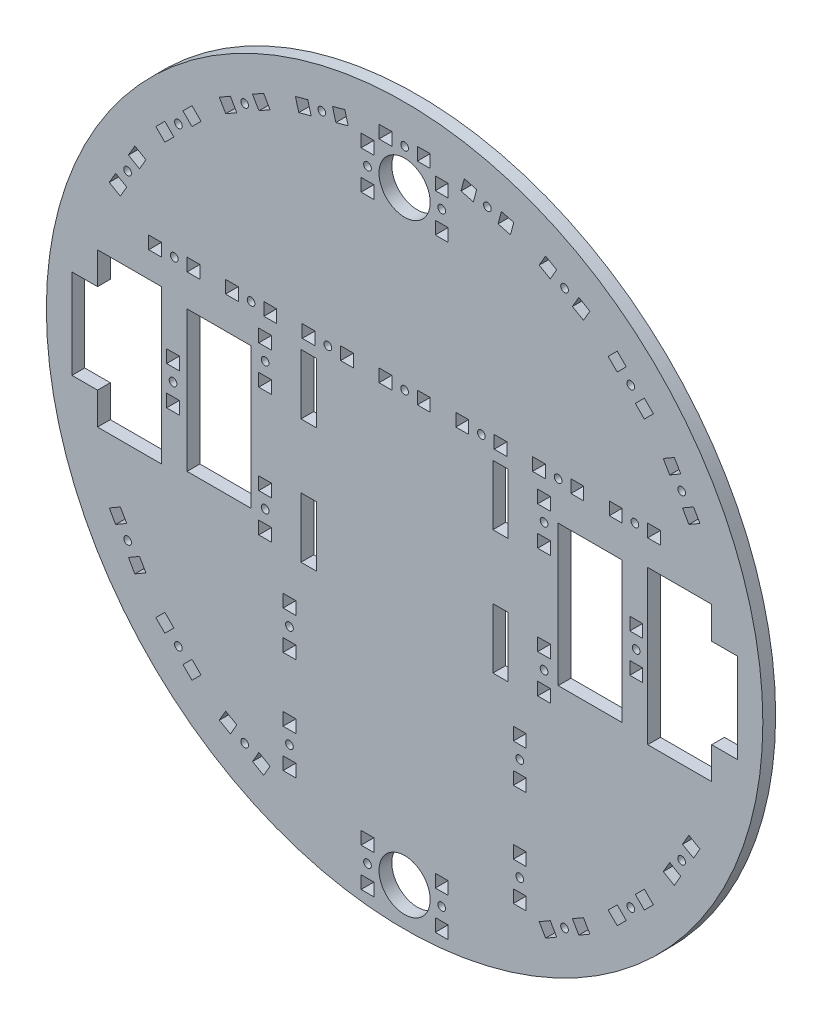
SolidWorks part; units mm, degrees
ref_plane "Plan de face" through (0, 0, 0) normal (0, 0, 1) x (1, 0, 0)
ref_plane "Plan de dessus" through (0, 0, 0) normal (0, 1, 0) x (1, 0, 0)
ref_plane "Plan de droite" through (0, 0, 0) normal (1, 0, 0) x (0, 0, -1)
sketch "Esquisse1" plane through (0, 0, 0) normal (0, 0, 1) x (1, 0, 0)
  line L0 (-52, 117.8953) -> (-52, -122.7008) construction
  line L1 (0, -140) -> (0, 140) construction
  line L2 (52, 117.8953) -> (52, -122.7008) construction
  line L3 (-140, 0) -> (140, 0) construction
  line L4 (-85, 27.5) -> (-85, -27.5)
  line L5 (85, 27.5) -> (60, 27.5)
  line L6 (85, 27.5) -> (85, -27.5)
  line L7 (85, -27.5) -> (60, -27.5)
  line L8 (60, 27.5) -> (60, -27.5)
  line L9 (-85, -27.5) -> (-60, -27.5)
  line L10 (-60, 27.5) -> (-60, -27.5)
  line L11 (-85, 27.5) -> (-60, 27.5)
  line L12 (45, -49.1556) -> (45, -122.7008) construction
  line L13 (-45, -49.1556) -> (-45, -122.7008) construction
  line L14 (-10, 139.6424) -> (-10, 125) construction
  line L15 (-10, 125) -> (10, 125) construction
  line L16 (10, 125) -> (10, 139.6424) construction
  line L17 (-52, 42.5) -> (52, 42.5) construction
  line L18 (95, 30) -> (95, -30)
  line L19 (95, -30) -> (120, -30)
  line L20 (120, -30) -> (120, -17.5)
  line L21 (120, -17.5) -> (130, -17.5)
  line L22 (130, -17.5) -> (130, 17.5)
  line L23 (130, 17.5) -> (120, 17.5)
  line L24 (120, 17.5) -> (120, 30)
  line L25 (120, 30) -> (95, 30)
  line L26 (-120, 17.5) -> (-120, 30)
  line L27 (-130, 17.5) -> (-120, 17.5)
  line L28 (-130, -17.5) -> (-130, 17.5)
  line L29 (-120, -17.5) -> (-130, -17.5)
  line L30 (-120, -30) -> (-120, -17.5)
  line L31 (-95, -30) -> (-120, -30)
  line L32 (-95, 30) -> (-95, -30)
  line L33 (-120, 30) -> (-95, 30)
  line L34 (-20.5104, -115) -> (24.0423, -115) construction
  line L35 (-26.3093, -125) -> (32.4158, -125) construction
  line L36 (-28.8401, -7) -> (32.4158, -7) construction
  line L37 (40.5, 36) -> (40.5, 12.5)
  line L38 (-40.5, 36) -> (-34.5, 36)
  line L39 (-40.5, 36) -> (-40.5, 12.5)
  line L40 (-40.5, 12.5) -> (-34.5, 12.5)
  line L41 (-34.5, 36) -> (-34.5, 12.5)
  line L42 (40.5, 12.5) -> (34.5, 12.5)
  line L43 (40.5, 36) -> (34.5, 36)
  line L44 (34.5, 36) -> (34.5, 12.5)
  line L45 (40.5, -36) -> (34.5, -36)
  line L46 (40.5, -36) -> (40.5, -12.5)
  line L47 (40.5, -12.5) -> (34.5, -12.5)
  line L48 (34.5, -36) -> (34.5, -12.5)
  line L49 (-40.5, -36) -> (-34.5, -36)
  line L50 (-34.5, -36) -> (-34.5, -12.5)
  line L51 (-40.5, -12.5) -> (-34.5, -12.5)
  line L52 (-40.5, -36) -> (-40.5, -12.5)
  circle A0 centre (0, 0) radius 140
  circle A1 centre (0, -125) radius 10
  circle A2 centre (0, 111) radius 10
  point P26 (0, 0)
  point P72 (-37.5, 36)
  line B0 (57, 30) -> (57, 35)
  line B1 (57, 30) -> (52, 30)
  line B2 (52, 30) -> (52, 35)
  line B3 (57, 35) -> (52, 35)
  line B4 (57, 20) -> (57, 15)
  line B5 (57, 20) -> (52, 20)
  line B6 (52, 20) -> (52, 15)
  line B7 (57, 15) -> (52, 15)
  line B8 (54.5, 25) -> (61.4724, 25) construction
  circle B9 centre (54.5, 25) radius 1.5
  line B10 (57, -30) -> (57, -35)
  line B11 (57, -30) -> (52, -30)
  line B12 (52, -30) -> (52, -35)
  line B13 (57, -35) -> (52, -35)
  line B14 (57, -20) -> (57, -15)
  line B15 (57, -20) -> (52, -20)
  line B16 (52, -20) -> (52, -15)
  line B17 (57, -15) -> (52, -15)
  line B18 (54.5, -25) -> (61.4724, -25) construction
  circle B19 centre (54.5, -25) radius 1.5
  line B20 (-57, -30) -> (-57, -35)
  line B21 (-57, -30) -> (-52, -30)
  line B22 (-52, -30) -> (-52, -35)
  line B23 (-57, -35) -> (-52, -35)
  line B24 (-57, -20) -> (-57, -15)
  line B25 (-57, -20) -> (-52, -20)
  line B26 (-52, -20) -> (-52, -15)
  line B27 (-57, -15) -> (-52, -15)
  circle B28 centre (-54.5, -25) radius 1.5
  line B29 (-57, 30) -> (-57, 35)
  line B30 (-57, 30) -> (-52, 30)
  line B31 (-52, 30) -> (-52, 35)
  line B32 (-57, 35) -> (-52, 35)
  line B33 (-57, 20) -> (-57, 15)
  line B34 (-57, 20) -> (-52, 20)
  line B35 (-52, 20) -> (-52, 15)
  line B36 (-57, 15) -> (-52, 15)
  circle B37 centre (-54.5, 25) radius 1.5
  line B38 (45, -65) -> (45, -55) construction
  line B39 (47.5, -65) -> (47.5, -70)
  line B40 (47.5, -65) -> (42.5, -65)
  line B41 (42.5, -65) -> (42.5, -70)
  line B42 (47.5, -70) -> (42.5, -70)
  line B43 (47.5, -55) -> (47.5, -50)
  line B44 (47.5, -55) -> (42.5, -55)
  line B45 (42.5, -55) -> (42.5, -50)
  line B46 (47.5, -50) -> (42.5, -50)
  line B47 (45, -60) -> (51.9724, -60) construction
  circle B48 centre (45, -60) radius 1.5
  line B49 (-47.5, -65) -> (-47.5, -70)
  line B50 (-47.5, -65) -> (-42.5, -65)
  line B51 (-42.5, -65) -> (-42.5, -70)
  line B52 (-47.5, -70) -> (-42.5, -70)
  line B53 (-47.5, -55) -> (-47.5, -50)
  line B54 (-47.5, -55) -> (-42.5, -55)
  line B55 (-42.5, -55) -> (-42.5, -50)
  line B56 (-47.5, -50) -> (-42.5, -50)
  circle B57 centre (-45, -60) radius 1.5
  line B58 (42.5, -95) -> (42.5, -90)
  line B59 (42.5, -95) -> (47.5, -95)
  line B60 (47.5, -95) -> (47.5, -90)
  line B61 (42.5, -90) -> (47.5, -90)
  line B62 (42.5, -105) -> (42.5, -110)
  line B63 (42.5, -105) -> (47.5, -105)
  line B64 (47.5, -105) -> (47.5, -110)
  line B65 (42.5, -110) -> (47.5, -110)
  line B66 (45, -100) -> (38.0276, -100) construction
  circle B67 centre (45, -100) radius 1.5
  line B68 (-47.5, -105) -> (-47.5, -110)
  line B69 (-47.5, -105) -> (-42.5, -105)
  line B70 (-42.5, -105) -> (-42.5, -110)
  line B71 (-47.5, -110) -> (-42.5, -110)
  line B72 (-47.5, -95) -> (-47.5, -90)
  line B73 (-47.5, -95) -> (-42.5, -95)
  line B74 (-42.5, -95) -> (-42.5, -90)
  line B75 (-47.5, -90) -> (-42.5, -90)
  circle B76 centre (-45, -100) radius 1.5
  line B77 (-5, 127.5) -> (-10, 127.5)
  line B78 (-5, 127.5) -> (-5, 122.5)
  line B79 (-5, 122.5) -> (-10, 122.5)
  line B80 (-10, 127.5) -> (-10, 122.5)
  line B81 (5, 127.5) -> (10, 127.5)
  line B82 (5, 127.5) -> (5, 122.5)
  line B83 (5, 122.5) -> (10, 122.5)
  line B84 (10, 127.5) -> (10, 122.5)
  circle B85 centre (0, 125) radius 1.5
  line B86 (28.1698, 124.4496) -> (23.3402, 125.7437)
  line B87 (28.1698, 124.4496) -> (26.8757, 119.62)
  line B88 (26.8757, 119.62) -> (22.0461, 120.9141)
  line B89 (23.3402, 125.7437) -> (22.0461, 120.9141)
  line B90 (37.8291, 121.8614) -> (42.6587, 120.5674)
  line B91 (37.8291, 121.8614) -> (36.535, 117.0318)
  line B92 (36.535, 117.0318) -> (41.3646, 115.7377)
  line B93 (42.6587, 120.5674) -> (41.3646, 115.7377)
  circle B94 centre (32.3524, 120.7407) radius 1.5
  line B95 (59.4199, 112.9182) -> (55.0897, 115.4182)
  line B96 (59.4199, 112.9182) -> (56.9199, 108.5881)
  line B97 (56.9199, 108.5881) -> (52.5897, 111.0881)
  line B98 (55.0897, 115.4182) -> (52.5897, 111.0881)
  line B99 (68.0801, 107.9182) -> (72.4103, 105.4182)
  line B100 (68.0801, 107.9182) -> (65.5801, 103.5881)
  line B101 (65.5801, 103.5881) -> (69.9103, 101.0881)
  line B102 (72.4103, 105.4182) -> (69.9103, 101.0881)
  circle B103 centre (62.5, 108.2532) radius 1.5
  line B104 (86.6206, 93.6916) -> (83.085, 97.2272)
  line B105 (86.6206, 93.6916) -> (83.085, 90.1561)
  line B106 (83.085, 90.1561) -> (79.5495, 93.6916)
  line B107 (83.085, 97.2272) -> (79.5495, 93.6916)
  line B108 (93.6916, 86.6206) -> (97.2272, 83.085)
  line B109 (93.6916, 86.6206) -> (90.1561, 83.085)
  line B110 (90.1561, 83.085) -> (93.6916, 79.5495)
  line B111 (97.2272, 83.085) -> (93.6916, 79.5495)
  circle B112 centre (88.3883, 88.3883) radius 1.5
  line B113 (107.9182, 68.0801) -> (105.4182, 72.4103)
  line B114 (107.9182, 68.0801) -> (103.5881, 65.5801)
  line B115 (103.5881, 65.5801) -> (101.0881, 69.9103)
  line B116 (105.4182, 72.4103) -> (101.0881, 69.9103)
  line B117 (112.9182, 59.4199) -> (115.4182, 55.0897)
  line B118 (112.9182, 59.4199) -> (108.5881, 56.9199)
  line B119 (108.5881, 56.9199) -> (111.0881, 52.5897)
  line B120 (115.4182, 55.0897) -> (111.0881, 52.5897)
  circle B121 centre (108.2532, 62.5) radius 1.5
  line B122 (112.9182, -59.4199) -> (115.4182, -55.0897)
  line B123 (112.9182, -59.4199) -> (108.5881, -56.9199)
  line B124 (108.5881, -56.9199) -> (111.0881, -52.5897)
  line B125 (115.4182, -55.0897) -> (111.0881, -52.5897)
  line B126 (107.9182, -68.0801) -> (105.4182, -72.4103)
  line B127 (107.9182, -68.0801) -> (103.5881, -65.5801)
  line B128 (103.5881, -65.5801) -> (101.0881, -69.9103)
  line B129 (105.4182, -72.4103) -> (101.0881, -69.9103)
  circle B130 centre (108.2532, -62.5) radius 1.5
  line B131 (93.6916, -86.6206) -> (97.2272, -83.085)
  line B132 (93.6916, -86.6206) -> (90.1561, -83.085)
  line B133 (90.1561, -83.085) -> (93.6916, -79.5495)
  line B134 (97.2272, -83.085) -> (93.6916, -79.5495)
  line B135 (86.6206, -93.6916) -> (83.085, -97.2272)
  line B136 (86.6206, -93.6916) -> (83.085, -90.1561)
  line B137 (83.085, -90.1561) -> (79.5495, -93.6916)
  line B138 (83.085, -97.2272) -> (79.5495, -93.6916)
  circle B139 centre (88.3883, -88.3883) radius 1.5
  line B140 (68.0801, -107.9182) -> (72.4103, -105.4182)
  line B141 (68.0801, -107.9182) -> (65.5801, -103.5881)
  line B142 (65.5801, -103.5881) -> (69.9103, -101.0881)
  line B143 (72.4103, -105.4182) -> (69.9103, -101.0881)
  line B144 (59.4199, -112.9182) -> (55.0897, -115.4182)
  line B145 (59.4199, -112.9182) -> (56.9199, -108.5881)
  line B146 (56.9199, -108.5881) -> (52.5897, -111.0881)
  line B147 (55.0897, -115.4182) -> (52.5897, -111.0881)
  circle B148 centre (62.5, -108.2532) radius 1.5
  line B149 (-59.4199, -112.9182) -> (-55.0897, -115.4182)
  line B150 (-59.4199, -112.9182) -> (-56.9199, -108.5881)
  line B151 (-56.9199, -108.5881) -> (-52.5897, -111.0881)
  line B152 (-55.0897, -115.4182) -> (-52.5897, -111.0881)
  line B153 (-68.0801, -107.9182) -> (-72.4103, -105.4182)
  line B154 (-68.0801, -107.9182) -> (-65.5801, -103.5881)
  line B155 (-65.5801, -103.5881) -> (-69.9103, -101.0881)
  line B156 (-72.4103, -105.4182) -> (-69.9103, -101.0881)
  circle B157 centre (-62.5, -108.2532) radius 1.5
  line B158 (-86.6206, -93.6916) -> (-83.085, -97.2272)
  line B159 (-86.6206, -93.6916) -> (-83.085, -90.1561)
  line B160 (-83.085, -90.1561) -> (-79.5495, -93.6916)
  line B161 (-83.085, -97.2272) -> (-79.5495, -93.6916)
  line B162 (-93.6916, -86.6206) -> (-97.2272, -83.085)
  line B163 (-93.6916, -86.6206) -> (-90.1561, -83.085)
  line B164 (-90.1561, -83.085) -> (-93.6916, -79.5495)
  line B165 (-97.2272, -83.085) -> (-93.6916, -79.5495)
  circle B166 centre (-88.3883, -88.3883) radius 1.5
  line B167 (-107.9182, -68.0801) -> (-105.4182, -72.4103)
  line B168 (-107.9182, -68.0801) -> (-103.5881, -65.5801)
  line B169 (-103.5881, -65.5801) -> (-101.0881, -69.9103)
  line B170 (-105.4182, -72.4103) -> (-101.0881, -69.9103)
  line B171 (-112.9182, -59.4199) -> (-115.4182, -55.0897)
  line B172 (-112.9182, -59.4199) -> (-108.5881, -56.9199)
  line B173 (-108.5881, -56.9199) -> (-111.0881, -52.5897)
  line B174 (-115.4182, -55.0897) -> (-111.0881, -52.5897)
  circle B175 centre (-108.2532, -62.5) radius 1.5
  line B176 (-112.9182, 59.4199) -> (-115.4182, 55.0897)
  line B177 (-112.9182, 59.4199) -> (-108.5881, 56.9199)
  line B178 (-108.5881, 56.9199) -> (-111.0881, 52.5897)
  line B179 (-115.4182, 55.0897) -> (-111.0881, 52.5897)
  line B180 (-107.9182, 68.0801) -> (-105.4182, 72.4103)
  line B181 (-107.9182, 68.0801) -> (-103.5881, 65.5801)
  line B182 (-103.5881, 65.5801) -> (-101.0881, 69.9103)
  line B183 (-105.4182, 72.4103) -> (-101.0881, 69.9103)
  circle B184 centre (-108.2532, 62.5) radius 1.5
  line B185 (-93.6916, 86.6206) -> (-97.2272, 83.085)
  line B186 (-93.6916, 86.6206) -> (-90.1561, 83.085)
  line B187 (-90.1561, 83.085) -> (-93.6916, 79.5495)
  line B188 (-97.2272, 83.085) -> (-93.6916, 79.5495)
  line B189 (-86.6206, 93.6916) -> (-83.085, 97.2272)
  line B190 (-86.6206, 93.6916) -> (-83.085, 90.1561)
  line B191 (-83.085, 90.1561) -> (-79.5495, 93.6916)
  line B192 (-83.085, 97.2272) -> (-79.5495, 93.6916)
  circle B193 centre (-88.3883, 88.3883) radius 1.5
  line B194 (-68.0801, 107.9182) -> (-72.4103, 105.4182)
  line B195 (-68.0801, 107.9182) -> (-65.5801, 103.5881)
  line B196 (-65.5801, 103.5881) -> (-69.9103, 101.0881)
  line B197 (-72.4103, 105.4182) -> (-69.9103, 101.0881)
  line B198 (-59.4199, 112.9182) -> (-55.0897, 115.4182)
  line B199 (-59.4199, 112.9182) -> (-56.9199, 108.5881)
  line B200 (-56.9199, 108.5881) -> (-52.5897, 111.0881)
  line B201 (-55.0897, 115.4182) -> (-52.5897, 111.0881)
  circle B202 centre (-62.5, 108.2532) radius 1.5
  line B203 (-37.8291, 121.8614) -> (-42.6587, 120.5674)
  line B204 (-37.8291, 121.8614) -> (-36.535, 117.0318)
  line B205 (-36.535, 117.0318) -> (-41.3646, 115.7377)
  line B206 (-42.6587, 120.5674) -> (-41.3646, 115.7377)
  line B207 (-28.1698, 124.4496) -> (-23.3402, 125.7437)
  line B208 (-28.1698, 124.4496) -> (-26.8757, 119.62)
  line B209 (-26.8757, 119.62) -> (-22.0461, 120.9141)
  line B210 (-23.3402, 125.7437) -> (-22.0461, 120.9141)
  circle B211 centre (-32.3524, 120.7407) radius 1.5
  line B212 (-93, 5) -> (-93, 10)
  line B213 (-93, 5) -> (-88, 5)
  line B214 (-88, 5) -> (-88, 10)
  line B215 (-93, 10) -> (-88, 10)
  line B216 (-93, -5) -> (-93, -10)
  line B217 (-93, -5) -> (-88, -5)
  line B218 (-88, -5) -> (-88, -10)
  line B219 (-93, -10) -> (-88, -10)
  circle B220 centre (-90.5, 0) radius 1.5
  line B221 (93, 5) -> (93, 10)
  line B222 (93, 5) -> (88, 5)
  line B223 (88, 5) -> (88, 10)
  line B224 (93, 10) -> (88, 10)
  line B225 (93, -5) -> (93, -10)
  line B226 (93, -5) -> (88, -5)
  line B227 (88, -5) -> (88, -10)
  line B228 (93, -10) -> (88, -10)
  circle B229 centre (90.5, 0) radius 1.5
  line B230 (85, 42.5) -> (95, 42.5) construction
  line B231 (85, 45) -> (80, 45)
  line B232 (85, 45) -> (85, 40)
  line B233 (85, 40) -> (80, 40)
  line B234 (80, 45) -> (80, 40)
  line B235 (95, 45) -> (100, 45)
  line B236 (95, 45) -> (95, 40)
  line B237 (95, 40) -> (100, 40)
  line B238 (100, 45) -> (100, 40)
  line B239 (90, 42.5) -> (90, 49.4724) construction
  circle B240 centre (90, 42.5) radius 1.5
  line B241 (-5, 42.5) -> (5, 42.5) construction
  line B242 (-5, 45) -> (-10, 45)
  line B243 (-5, 45) -> (-5, 40)
  line B244 (-5, 40) -> (-10, 40)
  line B245 (-10, 45) -> (-10, 40)
  line B246 (5, 45) -> (10, 45)
  line B247 (5, 45) -> (5, 40)
  line B248 (5, 40) -> (10, 40)
  line B249 (10, 45) -> (10, 40)
  line B250 (0, 42.5) -> (0, 49.4724) construction
  circle B251 centre (0, 42.5) radius 1.5
  line B252 (-95, 42.5) -> (-85, 42.5) construction
  line B253 (-95, 45) -> (-100, 45)
  line B254 (-95, 45) -> (-95, 40)
  line B255 (-95, 40) -> (-100, 40)
  line B256 (-100, 45) -> (-100, 40)
  line B257 (-85, 45) -> (-80, 45)
  line B258 (-85, 45) -> (-85, 40)
  line B259 (-85, 40) -> (-80, 40)
  line B260 (-80, 45) -> (-80, 40)
  line B261 (-90, 42.5) -> (-90, 49.4724) construction
  circle B262 centre (-90, 42.5) radius 1.5
  line B263 (25, 45) -> (20, 45)
  line B264 (25, 45) -> (25, 40)
  line B265 (25, 40) -> (20, 40)
  line B266 (20, 45) -> (20, 40)
  line B267 (35, 45) -> (40, 45)
  line B268 (35, 45) -> (35, 40)
  line B269 (35, 40) -> (40, 40)
  line B270 (40, 45) -> (40, 40)
  line B271 (30, 42.5) -> (30, 49.4724) construction
  circle B272 centre (30, 42.5) radius 1.5
  line B273 (-35, 45) -> (-40, 45)
  line B274 (-35, 45) -> (-35, 40)
  line B275 (-35, 40) -> (-40, 40)
  line B276 (-40, 45) -> (-40, 40)
  line B277 (-25, 45) -> (-20, 45)
  line B278 (-25, 45) -> (-25, 40)
  line B279 (-25, 40) -> (-20, 40)
  line B280 (-20, 45) -> (-20, 40)
  line B281 (-30, 42.5) -> (-30, 49.4724) construction
  circle B282 centre (-30, 42.5) radius 1.5
  line B283 (-65, 45) -> (-70, 45)
  line B284 (-65, 45) -> (-65, 40)
  line B285 (-65, 40) -> (-70, 40)
  line B286 (-70, 45) -> (-70, 40)
  line B287 (-55, 45) -> (-50, 45)
  line B288 (-55, 45) -> (-55, 40)
  line B289 (-55, 40) -> (-50, 40)
  line B290 (-50, 45) -> (-50, 40)
  line B291 (-60, 42.5) -> (-60, 49.4724) construction
  circle B292 centre (-60, 42.5) radius 1.5
  line B293 (55, 45) -> (50, 45)
  line B294 (55, 45) -> (55, 40)
  line B295 (55, 40) -> (50, 40)
  line B296 (50, 45) -> (50, 40)
  line B297 (65, 45) -> (70, 45)
  line B298 (65, 45) -> (65, 40)
  line B299 (65, 40) -> (70, 40)
  line B300 (70, 45) -> (70, 40)
  line B301 (60, 42.5) -> (60, 49.4724) construction
  circle B302 centre (60, 42.5) radius 1.5
  line B303 (17, -120) -> (17, -115)
  line B304 (17, -120) -> (12, -120)
  line B305 (12, -120) -> (12, -115)
  line B306 (17, -115) -> (12, -115)
  line B307 (17, -130) -> (17, -135)
  line B308 (17, -130) -> (12, -130)
  line B309 (12, -130) -> (12, -135)
  line B310 (17, -135) -> (12, -135)
  line B311 (14.5, -125) -> (21.4724, -125) construction
  circle B312 centre (14.5, -125) radius 1.5
  line B313 (-17, -120) -> (-17, -115)
  line B314 (-17, -120) -> (-12, -120)
  line B315 (-12, -120) -> (-12, -115)
  line B316 (-17, -115) -> (-12, -115)
  line B317 (-17, -130) -> (-17, -135)
  line B318 (-17, -130) -> (-12, -130)
  line B319 (-12, -130) -> (-12, -135)
  line B320 (-17, -135) -> (-12, -135)
  circle B321 centre (-14.5, -125) radius 1.5
  line B322 (-17, 106) -> (-17, 101)
  line B323 (-17, 106) -> (-12, 106)
  line B324 (-12, 106) -> (-12, 101)
  line B325 (-17, 101) -> (-12, 101)
  line B326 (-17, 116) -> (-17, 121)
  line B327 (-17, 116) -> (-12, 116)
  line B328 (-12, 116) -> (-12, 121)
  line B329 (-17, 121) -> (-12, 121)
  circle B330 centre (-14.5, 111) radius 1.5
  line B331 (17, 106) -> (17, 101)
  line B332 (17, 106) -> (12, 106)
  line B333 (12, 106) -> (12, 101)
  line B334 (17, 101) -> (12, 101)
  line B335 (17, 116) -> (17, 121)
  line B336 (17, 116) -> (12, 116)
  line B337 (12, 116) -> (12, 121)
  line B338 (17, 121) -> (12, 121)
  circle B339 centre (14.5, 111) radius 1.5
  dimension "D1" = 280
  dimension "D24" = 5
  dimension "D25" = 20
  dimension "D2" = 104
  dimension "D3" = 25
  dimension "D4" = 90
  dimension "D5" = 3
  dimension "D6" = 55
  dimension "D7" = 25
  dimension "D8" = 40
  dimension "D9" = 60
  dimension "D10" = 15
  dimension "D12" = 3
  dimension "D13" = 90
  dimension "D14" = 42.5
  dimension "D15" = 2
  dimension "D16" = 60
  dimension "D17" = 35
  dimension "D18" = 25
  dimension "D19" = 10
  dimension "D20" = 30
  dimension "D21" = 30
  dimension "D22" = 30
  dimension "D23" = 30
  dimension "D26" = 12
  dimension "D27" = 7
  dimension "D28" = 69
  dimension "D29" = 81
  dimension "D30" = 25
  dimension "D31" = 72
  dimension "D11" = 24
sketch_block_instance "Trou M3 plots 5mm-1"
sketch_block "Trou M3 plots 5mm" parameters "D2"=3, "D1"=5, "D3"=5, "D4"=10
sketch_block_instance "Trou M3 plots 5mm-2"
sketch_block_instance "Trou M3 plots 5mm-5"
sketch_block_instance "Trou M3 plots 5mm-7"
sketch_block_instance "Trou M3 plots 5mm-8"
sketch_block_instance "Trou M3 plots 5mm-9"
sketch_block_instance "Trou M3 plots 5mm-10"
sketch_block_instance "Trou M3 plots 5mm-11"
sketch_block_instance "Trou M3 plots 5mm-12"
sketch_block_instance "Trou M3 plots 5mm-59"
sketch_block_instance "Trou M3 plots 5mm-60"
sketch_block_instance "Trou M3 plots 5mm-61"
sketch_block_instance "Trou M3 plots 5mm-62"
sketch_block_instance "Trou M3 plots 5mm-64"
sketch_block_instance "Trou M3 plots 5mm-66"
sketch_block_instance "Trou M3 plots 5mm-67"
sketch_block_instance "Trou M3 plots 5mm-68"
sketch_block_instance "Trou M3 plots 5mm-69"
sketch_block_instance "Trou M3 plots 5mm-70"
sketch_block_instance "Trou M3 plots 5mm-71"
sketch_block_instance "Trou M3 plots 5mm-72"
sketch_block_instance "Trou M3 plots 5mm-73"
sketch_block_instance "Trou M3 plots 5mm-74"
sketch_block_instance "Trou M3 plots 5mm-76"
sketch_block_instance "Trou M3 plots 5mm-78"
sketch_block_instance "Trou M3 plots 5mm-79"
sketch_block_instance "Trou M3 plots 5mm-80"
sketch_block_instance "Trou M3 plots 5mm-81"
sketch_block_instance "Trou M3 plots 5mm-82"
sketch_block_instance "Trou M3 plots 5mm-83"
sketch_block_instance "Trou M3 plots 5mm-84"
sketch_block_instance "Trou M3 plots 5mm-85"
sketch_block_instance "Trou M3 plots 5mm-86"
sketch_block_instance "Trou M3 plots 5mm-87"
sketch_block_instance "Trou M3 plots 5mm-88"
sketch_block_instance "Trou M3 plots 5mm-89"
sketch_block_instance "Trou M3 plots 5mm-90"
sketch_block_instance "Trou M3 plots 5mm-91"
sketch_block_instance "Trou M3 plots 5mm-92"
sketch_block_instance "Trou M3 plots 5mm-93"
sketch_block_instance "Trou M3 plots 5mm-94"
sketch_block_instance "Trou M3 plots 5mm-96"
sketch_block_instance "Trou M3 plots 5mm-98"
sketch_block_instance "Trou M3 plots 5mm-101"
sketch_block_instance "Trou M3 plots 5mm-102"
extrude "Boss.-Extru.1" add sketch "Esquisse1" along normal blind 5
